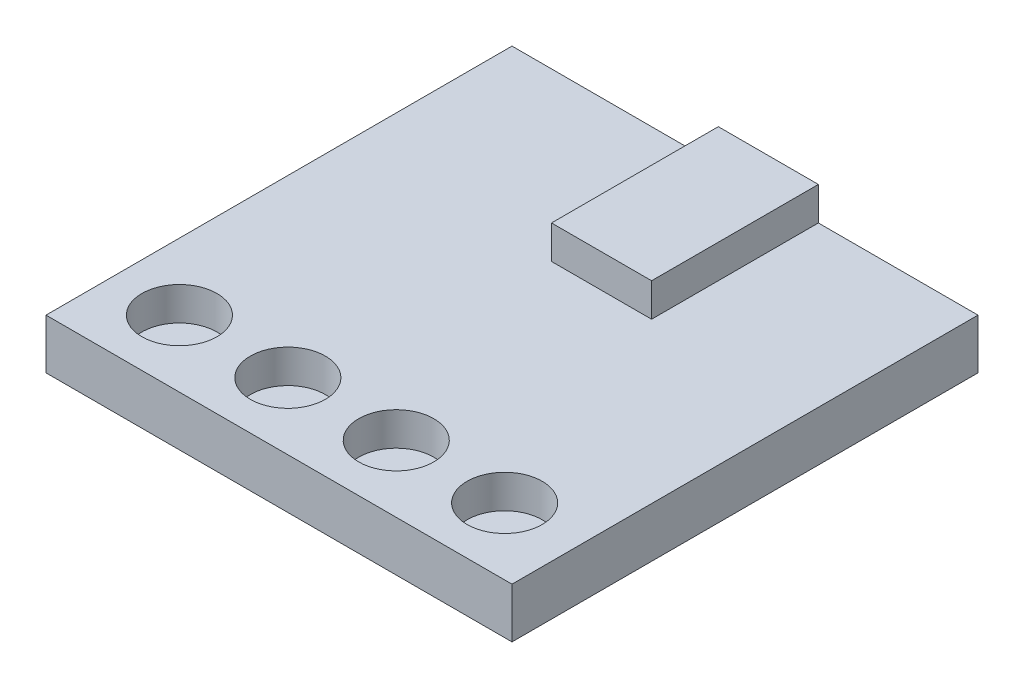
SolidWorks part; units mm, degrees
ref_plane "Front Plane" through (0, 0, 0) normal (0, 0, 1) x (1, 0, 0)
ref_plane "Top Plane" through (0, 0, 0) normal (0, 1, 0) x (1, 0, 0)
ref_plane "Right Plane" through (0, 0, 0) normal (1, 0, 0) x (0, 0, -1)
sketch "Sketch1" plane through (0, 0, 0) normal (0, 1, 0) x (1, 0, 0)
  line L1 (0, 0) -> (13.97, 0)
  line L2 (0, 0) -> (0, 13.97)
  line L3 (0, 13.97) -> (13.97, 13.97)
  line L4 (13.97, 0) -> (13.97, 13.97)
  dimension "D1" = 13.97
  dimension "D2" = 13.97
extrude "Boss-Extrude1" add sketch "Sketch1" along normal blind 1.5
sketch "Sketch2" plane through (0, 1.5, 0) normal (0, 1, 0) x (1, 0, 0)
  line L0 (0, 13.97) -> (0, 0) construction
  line L1 (0, 0) -> (13.97, 0) construction
  circle A0 centre (2, 2) radius 1.125
  circle A1 centre (5.25, 2) radius 1.125
  circle A2 centre (8.5, 2) radius 1.125
  circle A3 centre (11.75, 2) radius 1.125
  dimension "D3" = 2.25
  dimension "D1" = 2
  dimension "D2" = 2
  dimension "D4" = 4
extrude "Cut-Extrude1" cut sketch "Sketch2" against normal blind 1
sketch "Sketch3" plane through (0, 1.5, 0) normal (0, 1, 0) x (1, 0, 0)
  line L0 (6.1847, 13.97) -> (9.1847, 13.97)
  line L1 (13.97, 13.97) -> (0, 13.97) construction
  line L2 (9.1847, 13.97) -> (9.1847, 8.97)
  line L3 (9.1847, 8.97) -> (6.1847, 8.97)
  line L4 (6.1847, 8.97) -> (6.1847, 13.97)
  point P5 (7.6847, 13.97)
  dimension "D1" = 3
  dimension "D2" = 5
extrude "Boss-Extrude2" add sketch "Sketch3" along normal blind 1
